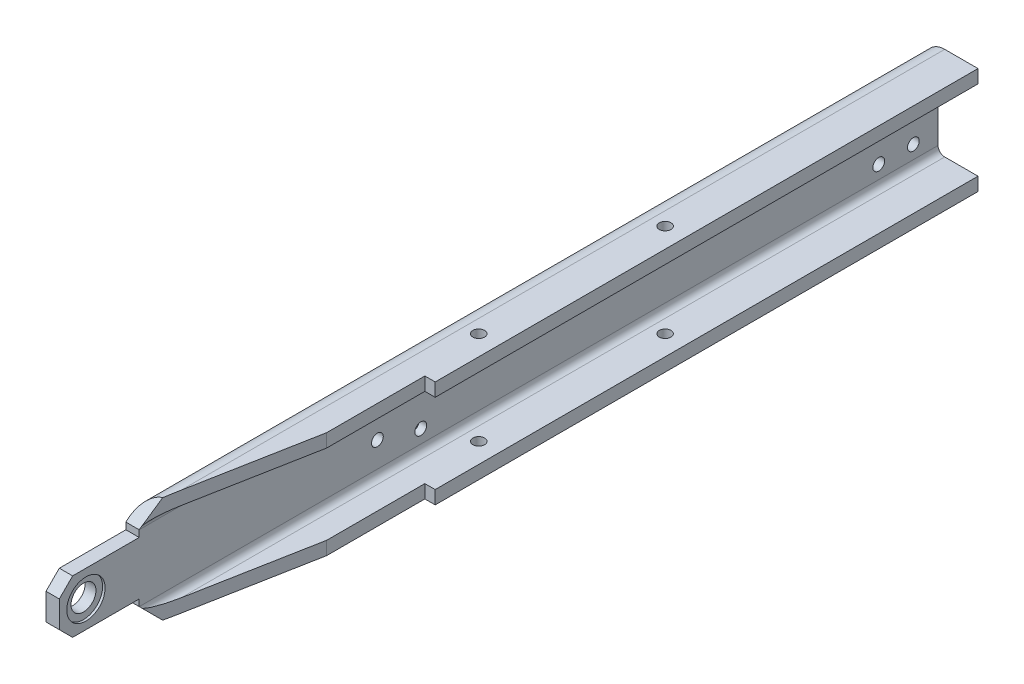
SolidWorks part; units mm, degrees
ref_plane "Plane1" through (0, 0, 0) normal (0, 0, 1) x (1, 0, 0)
ref_plane "Plane2" through (0, 0, 0) normal (0, 1, 0) x (1, 0, 0)
ref_plane "Plane3" through (0, 0, 0) normal (1, 0, 0) x (0, 0, -1)
sketch "Sketch1" plane through (0, 0, 0) normal (0, 0, 1) x (1, 0, 0)
  line L0 (0, -15.875) -> (0, 15.875)
  line L1 (9.525, 25.4) -> (25.4, 25.4)
  line L2 (9.525, -25.4) -> (25.4, -25.4)
  line L3 (9.525, 19.05) -> (25.4, 19.05)
  line L4 (6.35, -15.875) -> (6.35, 15.875)
  line L5 (9.525, -19.05) -> (25.4, -19.05)
  line L6 (25.4, 25.4) -> (25.4, 19.05)
  line L7 (25.4, -19.05) -> (25.4, -25.4)
  arc A0 (9.525, 19.05) -> (6.35, 15.875) centre (9.525, 15.875) ccw
  arc A1 (9.525, -19.05) -> (6.35, -15.875) centre (9.525, -15.875) cw
  arc A2 (9.525, 25.4) -> (0, 15.875) centre (9.525, 15.875) ccw
  arc A3 (9.525, -25.4) -> (0, -15.875) centre (9.525, -15.875) cw
  dimension "D6" = 3.175
  dimension "D7" = 9.525
  dimension "D1" = 25.4
  dimension "D2" = 50.8
  dimension "D3" = 25.4
  dimension "D4" = 6.35
  dimension "D8" = 25.4
  dimension "D5" = 6.35
extrude "Base-Extrude" add sketch "Sketch1" along normal blind 431.8
sketch "Sketch2" plane through (0, 0, 431.8) normal (0, 0, 1) x (1, 0, 0)
  line L0 (0, 12.7) -> (26.5655, 12.7)
  line L1 (26.5655, 12.7) -> (26.5655, 25.8892)
  line L2 (26.5655, 25.8892) -> (0, 25.8892)
  line L3 (0, 25.8892) -> (0, 12.7)
  line L4 (0, -12.7) -> (26.6058, -12.7)
  line L5 (26.6058, -12.7) -> (26.6058, -25.9785)
  line L6 (26.6058, -25.9785) -> (0, -25.9785)
  line L7 (0, -12.7) -> (0, -25.9785)
  line L8 (0, 15.875) -> (0, -15.875) construction
  dimension "D1" = 13.2785
  dimension "D2" = 13.1892
  dimension "D3" = 26.6058
  dimension "D4" = 26.5655
  dimension "D5" = 12.7
  dimension "D6" = 12.7
extrude "Cut-Extrude1" cut sketch "Sketch2" against normal blind 38.1
sketch "Sketch3" plane through (0, 25.4, 0) normal (0, 1, 0) x (-1, 0, 0)
  line L0 (-6.35, 393.7) -> (-25.4, 292.1)
  line L2 (-25.4, 393.7) -> (-25.4, 0) construction
  line L3 (-6.35, 393.7) -> (-25.4, 393.7)
  line L4 (-25.4, 393.7) -> (-25.4, 292.1)
  dimension "D1" = 101.6
extrude "Cut-Extrude2" cut sketch "Sketch3" against normal through all
sketch "Sketch4" plane through (6.35, 0, 0) normal (1, 0, 0) x (0, 0, -1)
  line L0 (-431.8, -12.7) -> (-431.8, 12.7) construction
  line L1 (-431.8, -12.7) -> (-393.7, -12.7) construction
  circle A0 centre (-419.1, 0) radius 5.9531
  dimension "D1" = 11.9062
  dimension "D2" = 12.7
  dimension "D3" = 12.7
extrude "Cut-Extrude3" cut sketch "Sketch4" against normal through all
chamfer "Chamfer1" distance 6.35 angle 45
sketch "Sketch5" plane through (6.35, 0, 0) normal (1, 0, 0) x (0, 0, -1)
  line L0 (-393.7, 15.875) -> (-393.7, 28.575)
  line L2 (-393.7, 28.575) -> (-381, 28.575)
  line L3 (-381, 28.575) -> (-393.7, 15.875)
  line L4 (-393.7, -15.875) -> (-393.7, -28.575)
  line L6 (-393.7, -28.575) -> (-381, -28.575)
  line L7 (-381, -28.575) -> (-393.7, -15.875)
  line L8 (-393.7, 15.875) -> (-393.7, 24.8553) construction
  line L9 (-425.45, -12.7) -> (-393.7, -12.7) construction
  line L10 (-425.45, 12.7) -> (-393.7, 12.7) construction
  dimension "D5" = 3.175
  dimension "D1" = 45
  dimension "D2" = 45
  dimension "D3" = 12.7
  dimension "D4" = 12.7
  dimension "D6" = 3.175
extrude "Cut-Extrude6" cut sketch "Sketch5" against normal through all and the other way through all
sketch "Sketch6" plane through (0, -25.4, 0) normal (0, -1, 0) x (1, 0, 0)
  line L0 (25.4, 292.1) -> (25.4, 0) construction
  line L2 (25.4, 292.1) -> (25.4, 0) construction
  circle A4 centre (15.875, 241.3) radius 2.794
  circle A5 centre (15.875, 152.4) radius 2.794
  dimension "D1" = 9.525
  dimension "D2" = 5.588
  dimension "D6" = 152.4
  dimension "D11" = 88.9
  dimension "D12" = 9.525
extrude "foam mount holes" cut sketch "Sketch6" against normal through all
sketch "Sketch7" plane through (6.35, 0, 0) normal (1, 0, 0) x (0, 0, -1)
  circle A1 centre (-419.1, 0) radius 4.7625
  circle A2 centre (-419.1, 0) radius 9.1313
  circle A3 centre (-419.1, 0) radius 5.9531 construction
  dimension "D1" = 18.2626
  dimension "D2" = 9.525
extrude "cone mount holes" cut sketch "Sketch7" against normal blind 1.1684
sketch "Sketch8" plane through (0, 0, 0) normal (-1, 0, 0) x (0, 0, 1)
  line L0 (259.4192, 266.7001) -> (259.4192, -266.7001) construction
  line L1 (24.4692, 266.7001) -> (24.4692, -266.7001) construction
  line L5 (0, 0) -> (168.9033, 0) construction
  line L6 (0, 15.875) -> (0, -15.875) construction
  circle A0 centre (22.352, 0) radius 3.3147 construction
  circle A1 centre (47.752, 0) radius 3.3147 construction
  circle A2 centre (259.4192, 9.525) radius 2.794
  circle A3 centre (259.4192, -9.525) radius 2.794
  circle A4 centre (24.4692, 9.525) radius 2.794
  circle A5 centre (24.4692, -9.525) radius 2.794
  dimension "D1" = 6.6294
  dimension "D10" = 9.525
  dimension "D12" = 5.588
  dimension "D2" = 22.352
  dimension "D3" = 25.4
  dimension "D8" = 9.525
  dimension "D9" = 9.525
extrude "frame mount holes" cut sketch "Sketch8" against normal through all
sketch "Sketch9" plane through (0, -13.0931, 38.712) normal (-1, 0, 0) x (0, 0, 1)
  line L0 (-26.012, 5.0921) -> (-26.012, 21.0941) construction
  line L1 (-29.187, 13.0931) -> (-22.837, 13.0931) construction
  line L2 (-29.187, 5.0921) -> (-29.187, 21.0941)
  line L3 (-22.837, 21.0941) -> (-22.837, 5.0921)
  line L4 (-38.712, 28.9681) -> (-38.712, -2.7819) construction
  line L5 (338.0547, -12.3069) -> (-38.712, -12.3069) construction
  arc A0 (-29.187, 21.0941) -> (-22.837, 21.0941) centre (-26.012, 21.0941) cw
  arc A1 (-29.187, 5.0921) -> (-22.837, 5.0921) centre (-26.012, 5.0921) ccw
  point P12 (-26.012, 13.0931)
  dimension "D1" = 12.7
  dimension "D2" = 25.4
  dimension "Slot width" = 6.35
  dimension "Slot length" = 22.352
sketch "Sketch10" plane through (0, 25.4, 0) normal (0, 1, 0) x (-1, 0, 0)
  line L1 (0, 0) -> (-25.4, 0)
  line L2 (0, 0) -> (0, 12.7)
  line L3 (0, 12.7) -> (-25.4, 12.7)
  line L4 (-25.4, 0) -> (-25.4, 12.7)
  dimension "D1" = 12.7
  dimension "D2" = 25.4
extrude "shorten length" cut sketch "Sketch10" against normal through all
sketch "Sketch11" plane through (0, 0, 0) normal (-1, 0, 0) x (0, 0, 1)
  line L2 (431.8, 6.35) -> (431.8, -6.35) construction
  line L3 (376.7667, -25.4) -> (12.7, -25.4) construction
  circle A0 centre (292.1, -7.9375) radius 3.556
  dimension "D1" = 7.112
  dimension "D2" = 17.4625
  dimension "D3" = 139.7
extrude "box bracket hole" [suppressed] cut sketch "Sketch11" against normal through all
hole_wizard "CSK for #10 Flat Head Socket Cap Screw1" positions "Sketch13" profile "Sketch12" countersink size "#10" standard "Ansi Inch"
sketch "Sketch13" plane through (0, 0, 0) normal (-1, 0, 0) x (0, 0, 1)
  point P0 (259.4192, 9.525)
sketch "Sketch12" plane through (0, 9.525, 259.4192) normal (0, 1, 0) x (0, 0, 1)
  line L0 (0, 0) -> (0, 27.0864)
  line L1 (0, 27.0864) -> (2.8067, 25.4)
  line L2 (2.8067, 25.4) -> (2.8067, 2.7758)
  line L3 (2.8067, 2.7758) -> (5.2197, 0)
  line L5 (5.2197, 0) -> (0, 0)
  line L6 (-2.8067, 2.7758) -> (-5.2197, 0) construction
  line L10 (0, 27.0864) -> (-2.8067, 25.4) construction
  line L11 (0, -6.35) -> (0, 107.95) construction
  dimension "Hole Dia." = 5.6134
  dimension "Hole Depth" = 25.4
  dimension "Near C'Sink Dia." = 10.4394
  dimension "Near C'Sink Angle" = 82
  dimension "Drill Angle" = 118
hole_wizard "Hole1" positions "Sketch14" profile "Sketch15" countersink size "#10" standard "Ansi Inch"
sketch "Sketch14" plane through (0, -14.1307, -8.3278) normal (-1, 0, 0) x (0, 0, 1)
  point P0 (267.7471, 4.6057)
sketch "Sketch15" plane through (0, -9.525, 259.4192) normal (0, 1, 0) x (0, 0, 1)
  line L0 (0, 0) -> (0, 27.0864)
  line L1 (0, 27.0864) -> (2.8067, 25.4)
  line L2 (2.8067, 25.4) -> (2.8067, 2.7758)
  line L3 (2.8067, 2.7758) -> (5.2197, 0)
  line L5 (5.2197, 0) -> (0, 0)
  line L6 (-2.8067, 2.7758) -> (-5.2197, 0) construction
  line L10 (0, 27.0864) -> (-2.8067, 25.4) construction
  line L11 (0, -6.35) -> (0, 107.95) construction
  dimension "Hole Dia." = 5.6134
  dimension "Hole Depth" = 25.4
  dimension "Near C'Sink Dia." = 10.4394
  dimension "Near C'Sink Angle" = 82
  dimension "Drill Angle" = 118
sketch "Sketch16" plane through (6.35, 0, 0) normal (1, 0, 0) x (0, 0, -1)
  line L0 (-12.7, -25.4) -> (-12.7, -19.05) construction
  line L1 (-292.1, -25.4) -> (-12.7, -25.4) construction
  circle A0 centre (-280.0985, -3.81) radius 2.8067
  dimension "D3" = 5.6134
  dimension "D1" = 267.3985
  dimension "D2" = 21.59
extrude "ElecBrktMount" cut sketch "Sketch16" against normal blind 15.24
sketch "Sketch17" plane through (6.35, 0, 0) normal (1, 0, 0) x (0, 0, -1)
  line L0 (-508.0476, 15.875) -> (-279.3048, 15.875) construction
  line L1 (-33.9942, 15.875) -> (-14.9442, 15.875) construction
  line L2 (-33.9942, 15.875) -> (-33.9942, -14.7054) construction
  line L3 (-33.9942, -14.7054) -> (-14.9442, -14.7054) construction
  line L4 (-14.9442, 15.875) -> (-14.9442, -14.7054) construction
  circle A0 centre (-40.9792, -9.525) radius 2.8067
  circle A1 centre (-40.9792, 9.525) radius 2.8067
  circle A3 centre (-40.9792, 9.525) radius 5.588 construction
  dimension "D1" = 5.6134
  dimension "D3" = 11.176
  dimension "D2" = 16.51
  dimension "D4" = 9.525
  dimension "D5" = 9.525
extrude "Cut-Extrude7" cut sketch "Sketch17" against normal through all
sketch "Sketch18" plane through (0, 25.4, 0) normal (0, 1, 0) x (-1, 0, 0)
  line L0 (-25.4, 271.5789) -> (-20.4691, 271.5789)
  line L1 (-25.4, 292.1) -> (-25.4, 12.7) construction
  line L2 (-20.4691, 271.5789) -> (-20.4691, 318.3982)
  line L3 (-25.4, 292.1) -> (-9.525, 376.7667) construction
  line L4 (-20.4691, 318.3982) -> (-25.4, 292.1)
  line L5 (-25.4, 292.1) -> (-25.4, 271.5789)
extrude "Cut-Extrude8" cut sketch "Sketch18" against normal through all
